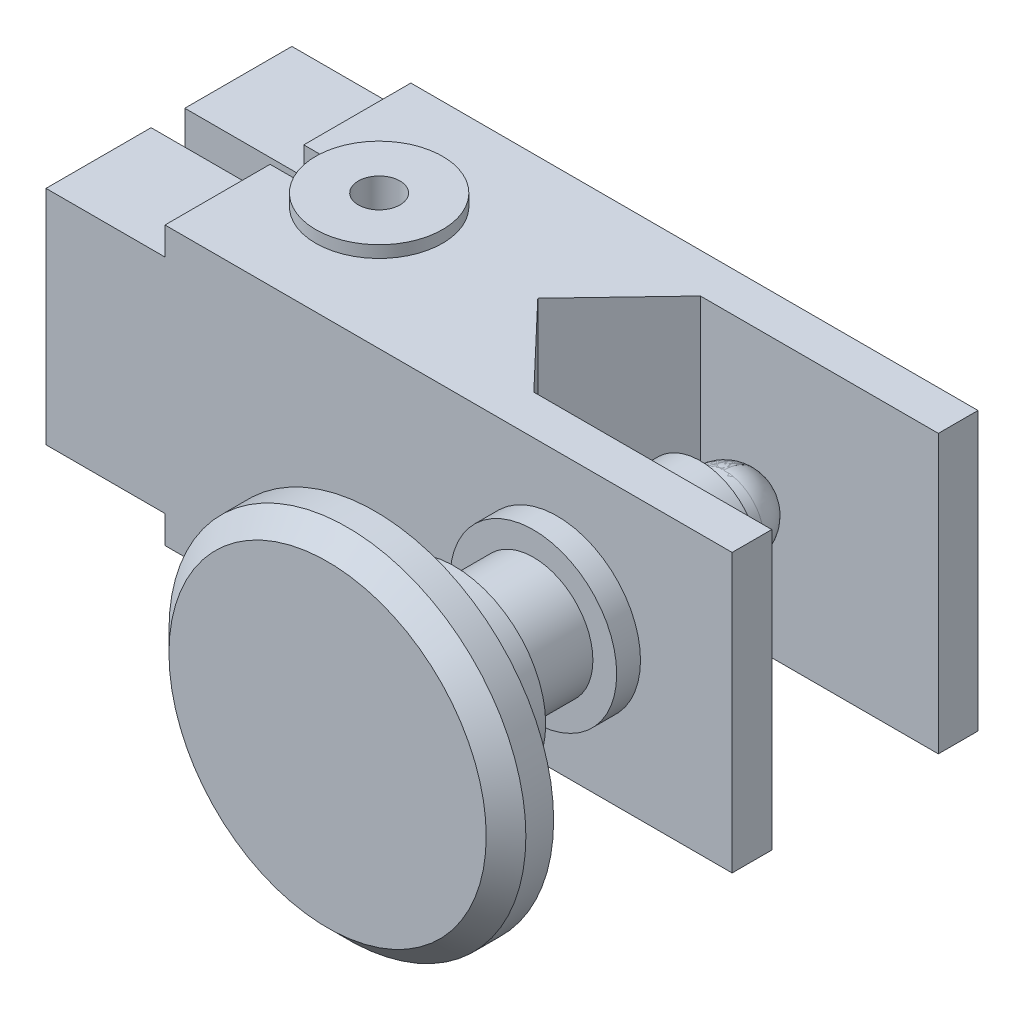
SolidWorks part; units mm, degrees
ref_plane "Plan de face" through (0, 0, 0) normal (0, 0, 1) x (1, 0, 0)
ref_plane "Plan de dessus" through (0, 0, 0) normal (0, 1, 0) x (1, 0, 0)
ref_plane "Plan de droite" through (0, 0, 0) normal (1, 0, 0) x (0, 0, -1)
imported_body "Importée4"
sketch "Esquisse1" plane through (0, 0, 0) normal (0, 1, 0) x (1, 0, 0)
  line L0 (66.0001, 11.0002) -> (85.9121, 11.0002)
  line L2 (66.0001, 11.0002) -> (76.0002, 11.0002) construction
  arc A0 (66.0001, 11.0002) -> (85.9121, 11.0002) centre (75.9561, 11.0439) cw
  spline S2 degree 3 poles (75.9998, 20.9997) (75.3453, 20.9997) (74.6908, 20.9353) (74.049, 20.8076) (73.4071, 20.6799) (72.7777, 20.489) (72.1731, 20.2386) (71.5684, 19.9881) (70.9885, 19.6781) (70.4443, 19.3145) (69.9001, 18.9509) (69.3918, 18.5337) (68.929, 18.0709) (68.4662, 17.6082) (68.049, 17.0998) (67.6854, 16.5556) (67.3218, 16.0115) (67.0118, 15.4315) (66.7613, 14.8268) (66.5109, 14.2222) (66.32, 13.5929) (66.1923, 12.951) (66.0646, 12.3091) (66.0001, 11.6546) (66.0001, 11.0002) knots 4.712389 4.712389 4.712389 4.712389 4.908739 4.908739 4.908739 5.105088 5.105088 5.105088 5.301438 5.301438 5.301438 5.497787 5.497787 5.497787 5.694137 5.694137 5.694137 5.890486 5.890486 5.890486 6.086836 6.086836 6.086836 6.283185 6.283185 6.283185 6.283185 construction
  dimension "D1" = 9.9561
revolve "Révolution1" add sketch "Esquisse1" angle 360 about L0
